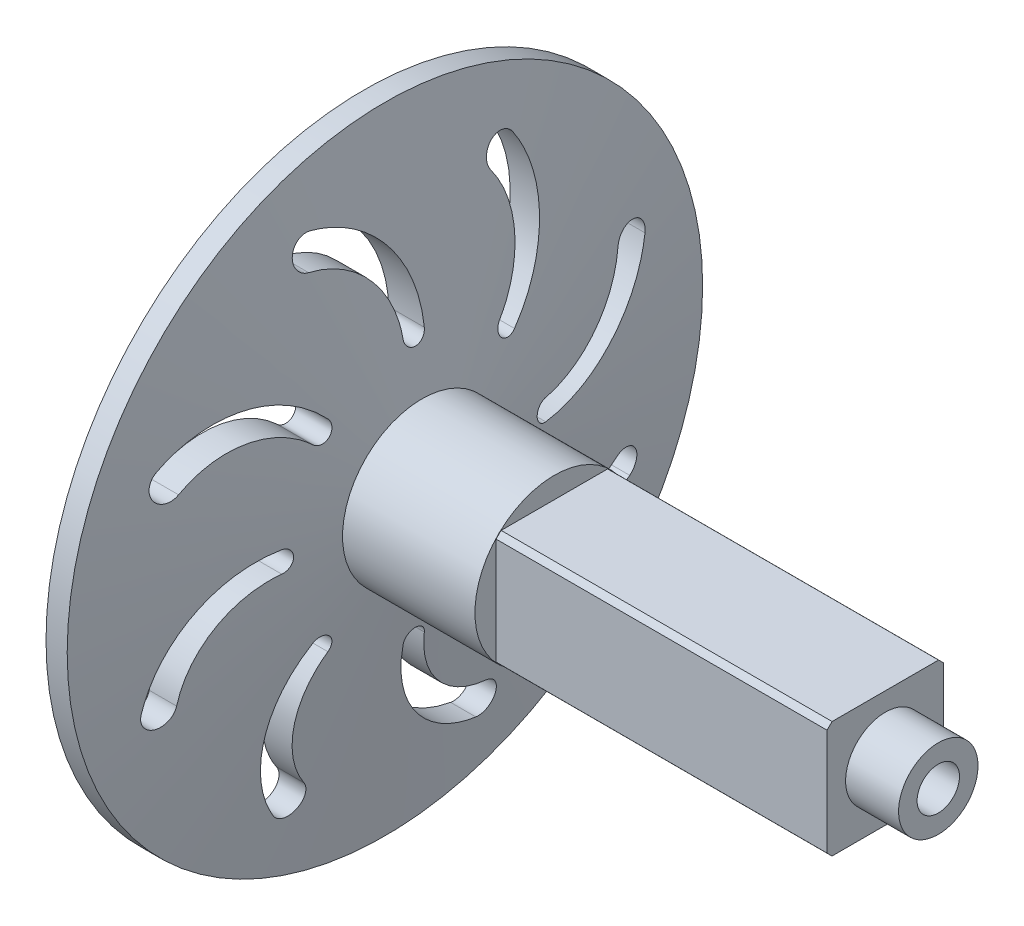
SolidWorks part; units mm, degrees
ref_plane "Front Plane" through (0, 0, 0) normal (0, 0, 1) x (1, 0, 0)
ref_plane "Top Plane" through (0, 0, 0) normal (0, 1, 0) x (1, 0, 0)
ref_plane "Right Plane" through (0, 0, 0) normal (1, 0, 0) x (0, 0, -1)
sketch "Sketch1" plane through (0, 0, 0) normal (1, 0, 0) x (0, 0, -1)
  circle A0 centre (0, 0) radius 19.05
  dimension "D1" = 38.1
extrude "Boss-Extrude1" add sketch "Sketch1" along normal blind 139.7
sketch "Sketch2" plane through (139.7, 0, 0) normal (1, 0, 0) x (0, 0, -1)
  line L1 (-13.97, 13.97) -> (13.97, 13.97)
  line L2 (-13.97, 13.97) -> (-13.97, -13.97)
  line L3 (-13.97, -13.97) -> (13.97, -13.97)
  line L4 (13.97, 13.97) -> (13.97, -13.97)
  circle A0 centre (0, 0) radius 19.05
  circle A1 centre (0, 0) radius 18.923
  dimension "D1" = 0.127
  dimension "D2" = 38.1
  dimension "D3" = 27.94
  dimension "D4" = 27.94
  dimension "D5" = 13.97
  dimension "D6" = 13.97
extrude "Cut-Extrude1" cut sketch "Sketch2" against normal blind 92.075 contours L1 A1 | L2 A1 | L3 A1 | L4 A1 | A1 L3 L4 M1 | A1 L3 M1 | A1 L4 M1 | A1 L4 L1 M1 | A1 L1 M1 | A1 L1 L2 M1 | A1 L2 M1 | A1 L2 L3 M1
sketch "Sketch3" plane through (139.7, 0, 0) normal (1, 0, 0) x (0, 0, -1)
  line L4 (13.97, -12.764) -> (13.97, 12.764)
  line L5 (12.764, 13.97) -> (-12.764, 13.97)
  line L6 (-13.97, 12.764) -> (-13.97, -12.764)
  line L7 (-12.764, -13.97) -> (12.764, -13.97)
  line L8 (13.97, -12.764) -> (13.97, 12.764)
  line L9 (12.764, 13.97) -> (-12.764, 13.97)
  line L10 (-13.97, 12.764) -> (-13.97, -12.764)
  line L11 (-12.764, -13.97) -> (12.764, -13.97)
  circle A0 centre (0, 0) radius 9.525
  arc A4 (13.97, 12.764) -> (12.764, 13.97) centre (0, 0) ccw
  arc A5 (-12.764, 13.97) -> (-13.97, 12.764) centre (0, 0) ccw
  arc A6 (-13.97, -12.764) -> (-12.764, -13.97) centre (0, 0) ccw
  arc A7 (12.764, -13.97) -> (13.97, -12.764) centre (0, 0) ccw
  arc A8 (13.97, 12.764) -> (12.764, 13.97) centre (0, 0) ccw
  arc A9 (-12.764, 13.97) -> (-13.97, 12.764) centre (0, 0) ccw
  arc A10 (-13.97, -12.764) -> (-12.764, -13.97) centre (0, 0) ccw
  arc A11 (12.764, -13.97) -> (13.97, -12.764) centre (0, 0) ccw
  dimension "D2" = 19.05
  dimension "D1" = 0
extrude "Cut-Extrude2" cut sketch "Sketch3" against normal blind 12.7
sketch "Sketch4" plane through (139.7, 0, 0) normal (1, 0, 0) x (0, 0, -1)
  circle A0 centre (0, 0) radius 5.08
  dimension "D1" = 10.16
extrude "Cut-Extrude3" cut sketch "Sketch4" against normal through all
sketch "Sketch5" plane through (0, 0, 0) normal (0, 0, 1) x (1, 0, 0)
  line L0 (47.625, 19.05) -> (0, 19.05) construction
  line L1 (15.875, 19.05) -> (6.35, 19.05)
  line L2 (6.35, 19.05) -> (1.905, 76.2)
  line L3 (1.905, 76.2) -> (6.985, 76.2)
  line L4 (6.985, 76.2) -> (15.875, 19.05)
  dimension "D1" = 5.08
  dimension "D2" = 6.35
  dimension "D3" = 57.15
  dimension "D4" = 31.75
  dimension "D5" = 1.905
revolve "Revolve1" add sketch "Sketch5" angle 360 about axis through (139.7, 0, 0) along (-1, 0, 0)
sketch "Sketch6" plane through (0, 0, 0) normal (-1, 0, 0) x (0, 0, 1)
  line L0 (-2.54, 12.4434) -> (-2.54, 14.9834)
  line L1 (-2.54, 14.9834) -> (2.54, 14.9834)
  line L2 (2.54, 14.9834) -> (2.54, 12.4434)
  arc A0 (-2.54, 12.4434) -> (2.54, 12.4434) centre (0, 0) ccw
  dimension "D1" = 25.4
  dimension "D2" = 5.08
  dimension "D3" = 2.54
extrude "Cut-Extrude4" cut sketch "Sketch6" against normal blind 44.45
sketch "Sketch7" plane through (0, 0, 0) normal (-1, 0, 0) x (0, 0, 1)
  line L0 (0, 0) -> (0, 31.75) construction
  line L1 (0, 0) -> (20.6324, 56.687) construction
  circle A0 centre (0, 0) radius 31.75 construction
  circle A1 centre (0, 0) radius 60.325 construction
  arc A2 (-2.538, 31.6484) -> (19.8444, 60.4146) centre (25.6865, 32.7783) cw
  arc A3 (2.538, 31.6484) -> (21.2673, 52.9302) centre (25.0162, 30.7485) cw
  arc A4 (0, 31.75) -> (20.6324, 56.687) centre (25.386, 31.75) cw construction
  arc A5 (21.2673, 52.9302) -> (19.8444, 60.4146) centre (20.6324, 56.687) ccw
  arc A6 (-2.538, 31.6484) -> (2.538, 31.6484) centre (0, 31.75) ccw
  point P8 (15.2024, 80.0905)
  dimension "D1" = 63.5
  dimension "D2" = 120.65
  dimension "D3" = 20
  dimension "D4" = 3.81
  dimension "D5" = 2.54
extrude "Cut-Extrude5" cut sketch "Sketch7" against normal through all
pattern_circular "CirPattern1" count 8 over 360 about axis through (0, 0, 0) along (1, 0, 0) of "Cut-Extrude5"
